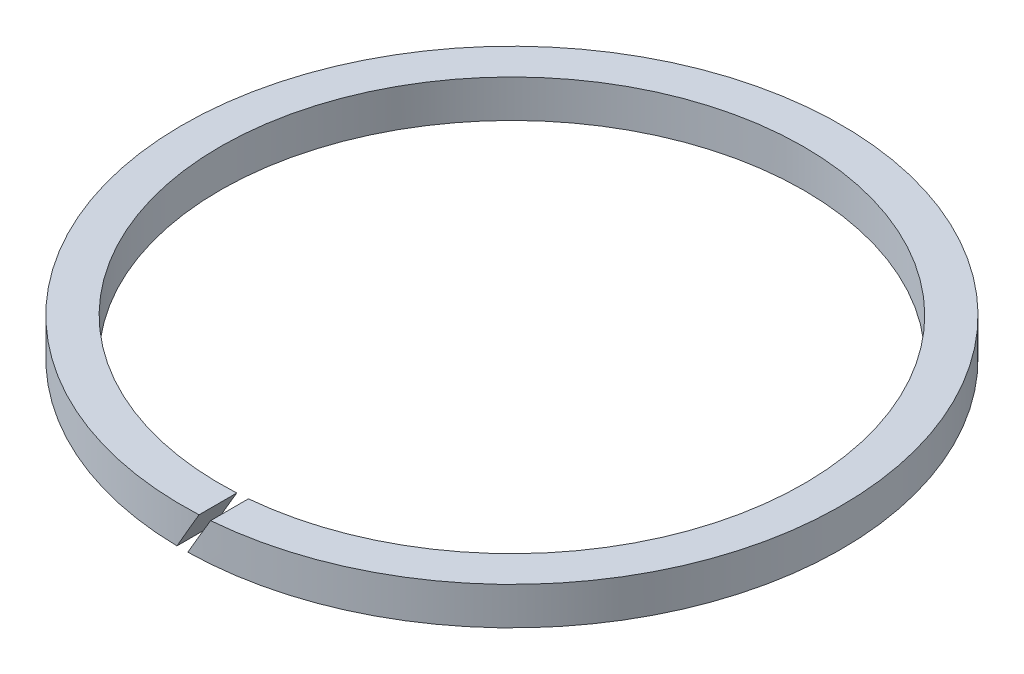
SolidWorks part; units mm, degrees
ref_plane "face" through (0, 0, 0) normal (0, 0, 1) x (1, 0, 0)
ref_plane "dessus" through (0, 0, 0) normal (0, 1, 0) x (1, 0, 0)
ref_plane "profil" through (0, 0, 0) normal (1, 0, 0) x (0, 0, -1)
sketch "Esquisse1" plane through (0, 0, 0) normal (0, 0, 1) x (1, 0, 0)
  line L0 (0, 50.034) -> (0, -35.6406) construction
  line L2 (15.5, 0) -> (17.5, 0)
  line L3 (15.5, 0) -> (15.5, 2)
  line L4 (15.5, 2) -> (17.5, 2)
  line L5 (17.5, 0) -> (17.5, 2)
  dimension "D1" = 2
  dimension "D2" = 2
  dimension "D3" = 17.5
revolve "Base-Révolution" add sketch "Esquisse1" angle 360 about L0
sketch "Esquisse2" plane through (0, 0, 0) normal (0, 0, 1) x (1, 0, 0)
  line L0 (0, 0) -> (6.2393, 10.8067) construction
  line L1 (-17.5, 0) -> (17.5, 0) construction
  line L2 (1.9443, 2.8677) -> (-0.3272, -1.0668)
  line L3 (1.367, 2.8677) -> (-0.9046, -1.0668)
  line L4 (1.367, 2.8677) -> (1.9443, 2.8677)
  line L5 (-0.9046, -1.0668) -> (-0.3272, -1.0668)
  dimension "D1" = 60
  dimension "D2" = 0.25
  dimension "D3" = 0.25
extrude "Enlèv. mat.-Extru.1" cut sketch "Esquisse2" along normal through all
